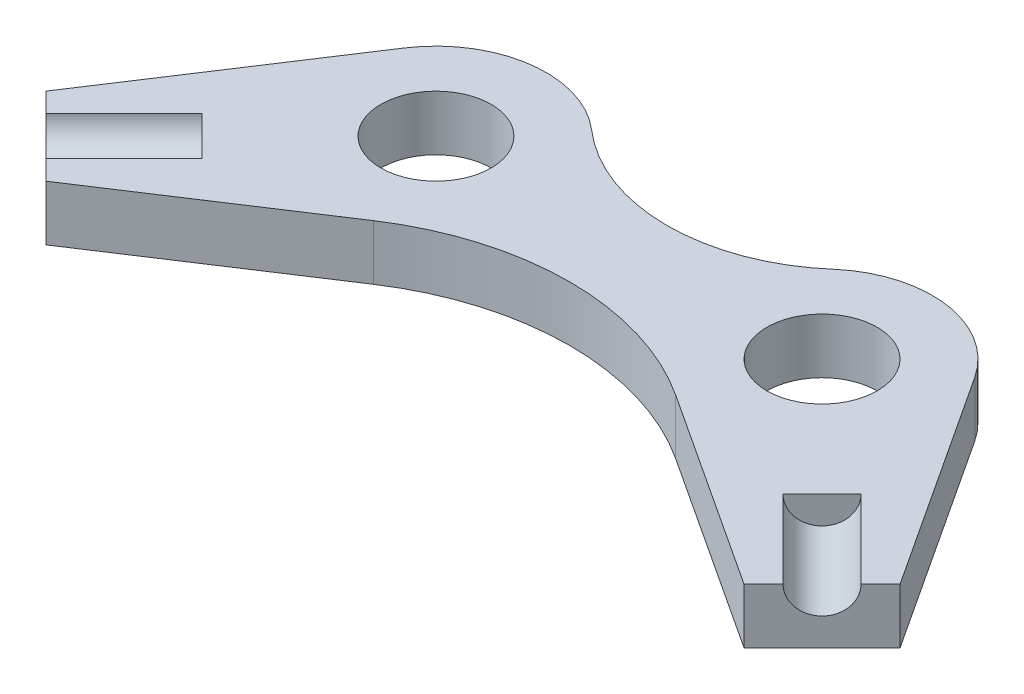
SolidWorks part; units mm, degrees
ref_plane "Alzado" through (0, 0, 0) normal (0, 0, 1) x (1, 0, 0)
ref_plane "Planta" through (0, 0, 0) normal (0, 1, 0) x (1, 0, 0)
ref_plane "Vista lateral" through (0, 0, 0) normal (1, 0, 0) x (0, 0, -1)
sketch "Croquis1" plane through (0, 0, 0) normal (0, 1, 0) x (1, 0, 0)
  line L0 (21419.2982, 4422.6237) -> (21398.085, 4443.8369)
  line L1 (21398.085, 4443.8369) -> (21436.6264, 4502.6974)
  line L2 (21419.2982, 4422.6237) -> (21473.1393, 4457.8785)
  line L3 (21609.151, 4422.6237) -> (21630.3642, 4443.8369)
  line L4 (21630.3642, 4443.8369) -> (21591.8228, 4502.6974)
  line L5 (21609.151, 4422.6237) -> (21555.3099, 4457.8785)
  circle A0 centre (21461.7246, 4486.2633) radius 4
  arc A1 (21481.4121, 4508.8996) -> (21436.6264, 4502.6974) centre (21461.7246, 4486.2633) ccw
  circle A2 centre (21566.7246, 4486.2633) radius 4
  arc A3 (21591.8228, 4502.6974) -> (21547.0371, 4508.8996) centre (21566.7246, 4486.2633) ccw
  arc A4 (21555.3099, 4457.8785) -> (21473.1393, 4457.8785) centre (21514.2246, 4395.1329) ccw
  arc A5 (21481.4121, 4508.8996) -> (21547.0371, 4508.8996) centre (21514.2246, 4546.6268) ccw
extrude "Saliente-Extruir1" add sketch "Croquis1" along normal blind 15
sketch "Croquis2" plane through (0, 15, 0) normal (0, 1, 0) x (1, 0, 0)
  circle A0 centre (21461.7246, 4486.2633) radius 15
  circle A1 centre (21566.7246, 4486.2633) radius 15
  dimension "D1" = 30
extrude "Cortar-Extruir1" cut sketch "Croquis2" against normal through all
sketch "Croquis3" plane through (12920.961, 0, -12920.961) normal (-0.7071, 0, 0.7071) x (0.7071, 0, 0.7071)
  line L0 (11988.4638, 15) -> (12018.4638, 15) construction
  circle A0 centre (12003.4638, 15) radius 7.5
  dimension "D1" = 15
extrude "Cortar-Extruir2" cut sketch "Croquis3" against normal blind 30
sketch "Croquis4" plane through (8593.2637, 0, 8593.2637) normal (0.7071, 0, 0.7071) x (0.7071, 0, -0.7071)
  line L0 (18407.2444, 15) -> (18437.2444, 15) construction
  circle A0 centre (18422.2444, 15) radius 7.5
  dimension "D1" = 15
extrude "Cortar-Extruir3" cut sketch "Croquis4" against normal blind 30
